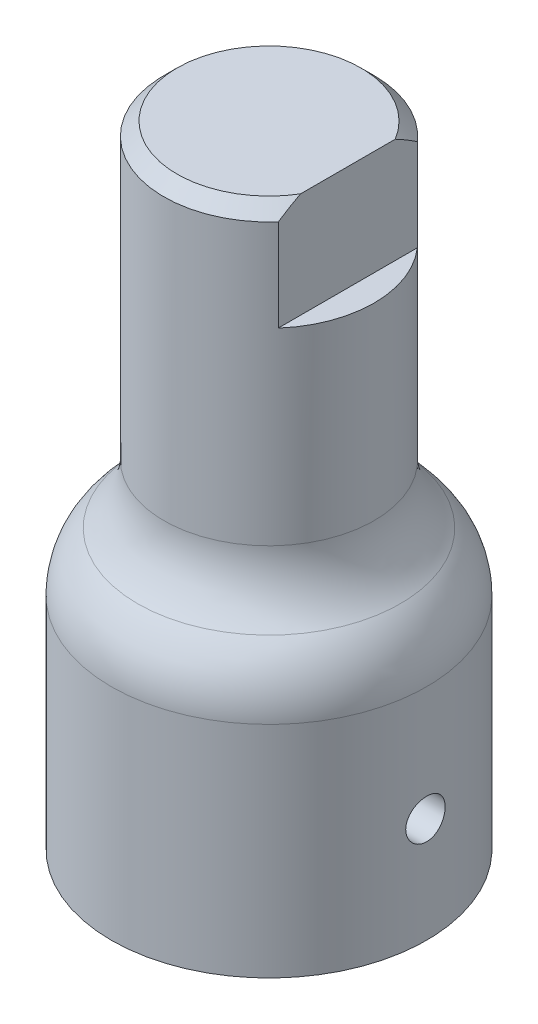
SolidWorks part; units mm, degrees
ref_plane "Front" through (0, 0, 0) normal (0, 0, 1) x (1, 0, 0)
ref_plane "Top" through (0, 0, 0) normal (0, 1, 0) x (-1, 0, 0)
ref_plane "Right" through (0, 0, 0) normal (1, 0, 0) x (0, 0, -1)
sketch "Sketch1" plane through (0, 0, 0) normal (0, 1, 0) x (-1, 0, 0)
  circle A0 centre (0, 0) radius 6.35
  dimension "D1" = 12.7
extrude "Base-Extrude" add sketch "Sketch1" along normal blind 38.1
sketch "Sketch3" plane through (0, 0, 0) normal (0, 1, 0) x (-1, 0, 0)
  circle A1 centre (0, 0) radius 9.525
  circle A2 centre (0, 0) radius 9.525
  dimension "D1" = 3.175
extrude "Boss-Extrude1" add sketch "Sketch3" along normal blind 15.875
sketch "Sketch4" plane through (0, 0, 0) normal (0, 1, 0) x (-1, 0, 0)
  line L0 (-4.7625, 4.2001) -> (-4.7625, -4.2001)
  circle A0 centre (0, 0) radius 6.35 construction
  arc A1 (-4.7625, -4.2001) -> (-4.7625, 4.2001) centre (0, 0) ccw
  dimension "D1" = 1.5875
extrude "Cut-Extrude1" cut sketch "Sketch4" along normal blind 12.7
fillet "Fillet1" radius 4.7625 1 edges at (0, 15.875, 6.35)
fillet "Fillet2" radius 4.7625 1 edges at (0, 15.875, 9.525)
sketch "Sketch5" plane through (4.7625, 0, 0) normal (-1, 0, 0) x (0, 0, 1)
  line L0 (4.2001, 0) -> (-4.2001, 0) construction
  circle A0 centre (0, 6.35) radius 1.1906
  dimension "D2" = 2.3813
  dimension "D1" = 6.35
extrude "Cut-Extrude2" cut sketch "Sketch5" against normal through all
sketch "Sketch7"
  line L0 (-4.7625, 4.2001) -> (-4.7625, -4.2001) construction
  line L1 (-4.7625, 4.2001) -> (-4.7625, -4.2001)
  circle A0 centre (0, 0) radius 6.35 construction
  arc A1 (-4.7625, 4.2001) -> (-4.7625, -4.2001) centre (0, 0) ccw
extrude "Cut-Extrude3" cut sketch "Sketch7" against normal blind 6.35
chamfer "Chamfer1" distance 0.7937 angle 45 1 edges at (-6.35, 38.1, 0)
